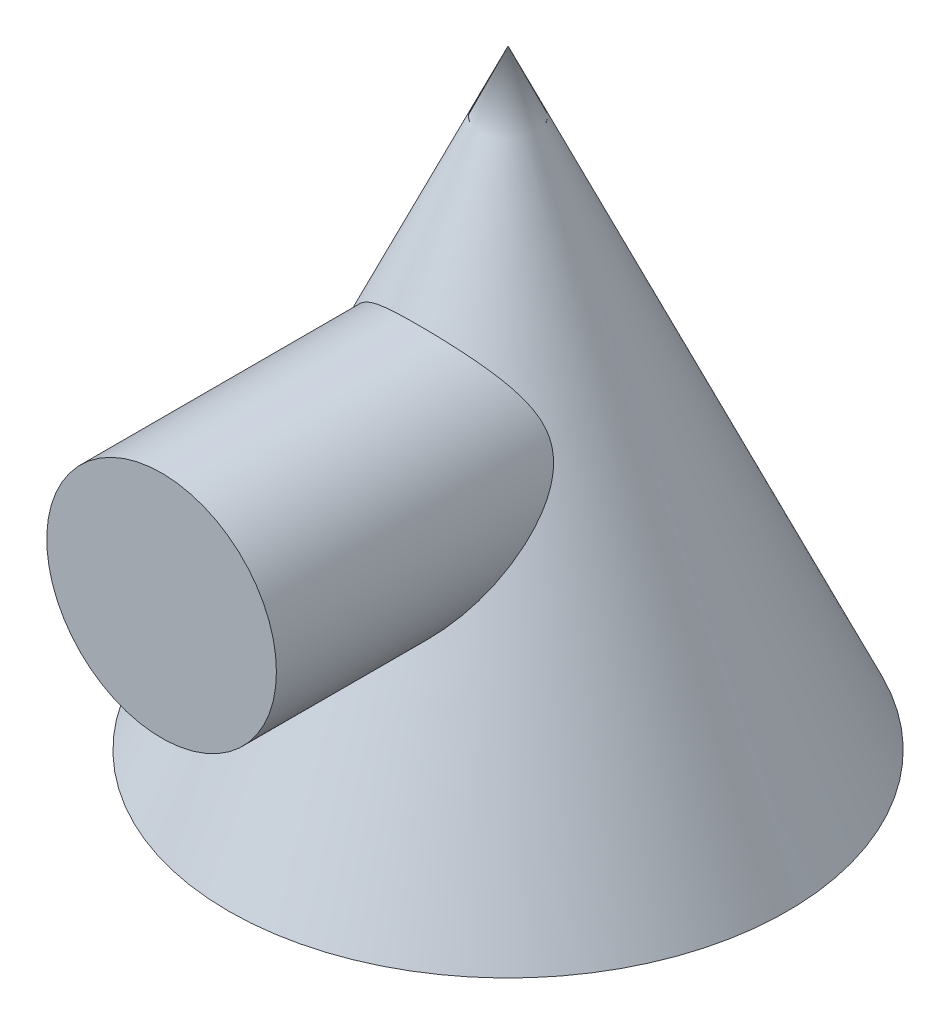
SolidWorks part; units mm, degrees
ref_plane "前视基准面" through (0, 0, 0) normal (0, 0, 1) x (1, 0, 0)
ref_plane "上视基准面" through (0, 0, 0) normal (0, 1, 0) x (1, 0, 0)
ref_plane "右视基准面" through (0, 0, 0) normal (1, 0, 0) x (0, 0, -1)
sketch "草图1" plane through (0, 0, 0) normal (0, 0, 1) x (1, 0, 0)
  line L0 (0, 58.2706) -> (0, -46.3176) construction
  line L1 (0, 41.1301) -> (-25, -13.4135)
  line L2 (-25, -13.4135) -> (0, -13.4135)
  line L3 (0, 41.1301) -> (0, -13.4135)
  dimension "D1" = 60
  dimension "D2" = 25
revolve "旋转1" add sketch "草图1" angle 360 about L0
ref_plane "基准面1" through (0, 0, 1) normal (0, 0, 1) x (1, 0, 0)
sketch "草图2" plane through (0, 0, 1) normal (0, 0, 1) x (1, 0, 0)
  line L0 (0, 64.3625) -> (0, -37.8131) construction
  circle A0 centre (0, 13.2747) radius 10.2744
extrude "拉伸1" add sketch "草图2" along normal blind 30
